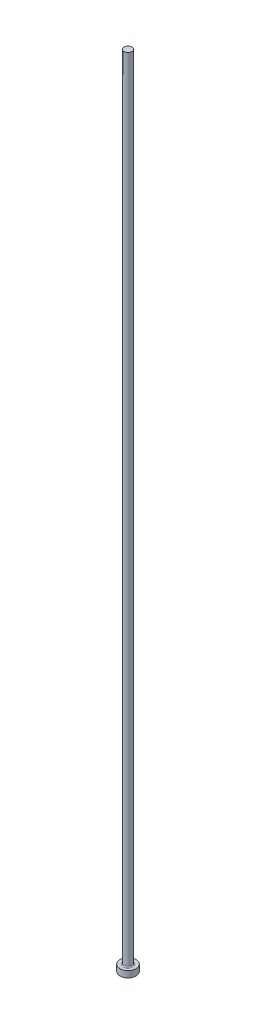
SolidWorks part; units mm, degrees
ref_plane "Plano frontal" through (0, 0, 0) normal (0, 0, 1) x (1, 0, 0)
ref_plane "Plano superior" through (0, 0, 0) normal (0, 1, 0) x (1, 0, 0)
ref_plane "Plano direito" through (0, 0, 0) normal (1, 0, 0) x (0, 0, -1)
sketch "Esboço1" plane through (0, 0, 0) normal (0, 0, 1) x (1, 0, 0)
  line L0 (0, 0) -> (2.5, 0)
  line L1 (2.5, 0) -> (2.5, 2)
  line L2 (2.5, 2) -> (1.55, 2)
  line L3 (1.25, 2.3) -> (1.25, 250)
  line L4 (1.25, 250) -> (0, 250)
  line L5 (0, 250) -> (0, 0) construction
  line L6 (0, 0) -> (0, 250)
  arc A0 (1.55, 2) -> (1.25, 2.3) centre (1.55, 2.3) cw
  dimension "D3" = 0.3
  dimension "D1" = 5
  dimension "D2" = 2.5
  dimension "D4" = 2
  dimension "D5" = 250
revolve "Revolução1" add sketch "Esboço1" angle 360 about L5
sketch "Esboço2"
  dimension "D1" = 0.2812
  dimension "D2" = 0.4375
  dimension "D3" = 0.1875
  dimension "D4" = 1.3438
wrap "Envolver1" sketch "Esboço2" wrap type deboss source sketch "Esboço2" thickness 0.1 parameters "D1"=0.1
